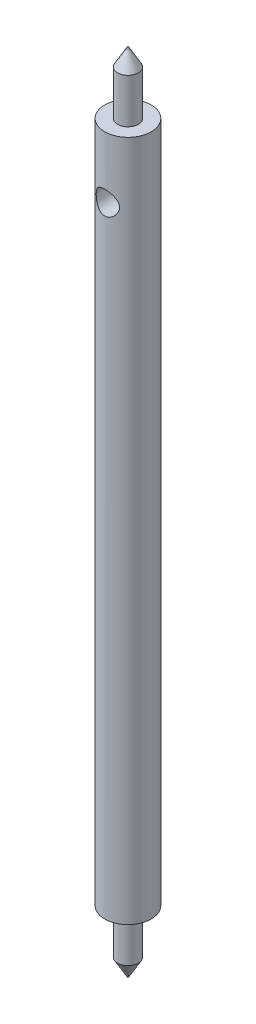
SolidWorks part; units mm, degrees
ref_plane "Front Plane" through (0, 0, 0) normal (0, 0, 1) x (1, 0, 0)
ref_plane "Top Plane" through (0, 0, 0) normal (0, 1, 0) x (1, 0, 0)
ref_plane "Right Plane" through (0, 0, 0) normal (1, 0, 0) x (0, 0, -1)
sketch "Sketch2" plane through (0, 0, 0) normal (0, 1, 0) x (1, 0, 0)
  circle A0 centre (0, 0) radius 2.3813
  dimension "D1" = 4.7625
extrude "Boss-Extrude1" add sketch "Sketch2" along normal blind 69.85
sketch "Sketch3" plane through (0, 69.85, 0) normal (0, 1, 0) x (1, 0, 0)
  circle A0 centre (0, 0) radius 1.0668
  dimension "D1" = 2.1336
extrude "Boss-Extrude2" add sketch "Sketch3" along normal blind 4.572
sketch "Sketch4" plane through (0, 0, 0) normal (0, -1, 0) x (1, 0, 0)
  circle A0 centre (0, 0) radius 1.0668
  dimension "D1" = 2.1336
extrude "Boss-Extrude3" add sketch "Sketch4" along normal blind 4.572
sketch "Sketch7" plane through (0, 0, 0) normal (0, 0, 1) x (1, 0, 0)
  line L0 (0, 74.422) -> (0, 76.2698) construction
  line L1 (0, 74.422) -> (-1.0668, 74.422)
  line L2 (-1.0668, 74.422) -> (0, 76.2698)
  line L3 (0, 76.2698) -> (0, 74.422)
  line L4 (1.0668, 74.422) -> (-1.0668, 74.422) construction
  point P3 (0, 74.5375)
  point P6 (0, 72.391)
  point P7 (0, 73.025)
  dimension "D1" = 300
sketch "Sketch10" plane through (0, 0, 0) normal (0, 0, 1) x (1, 0, 0)
  line L3 (1.0668, -4.572) -> (0, -6.4198)
  line L4 (0, 0) -> (0, -9.8253) construction
  line L5 (1.0668, -4.572) -> (0, -4.572)
  line L6 (0, -4.572) -> (0, -6.4198)
  dimension "D1" = 300
revolve "Revolve3" add sketch "Sketch10" angle 360 about L4
revolve "Revolve4" add sketch "Sketch7" angle 360 about L0
sketch "Sketch11" plane through (0, 0, 0) normal (0, 0, 1) x (1, 0, 0)
  circle A0 centre (0, 63.5698) radius 1.1906
  dimension "D1" = 2.3813
  dimension "D2" = 12.7
extrude "Cut-Extrude1" cut sketch "Sketch11" against normal through all both and the other way through all
